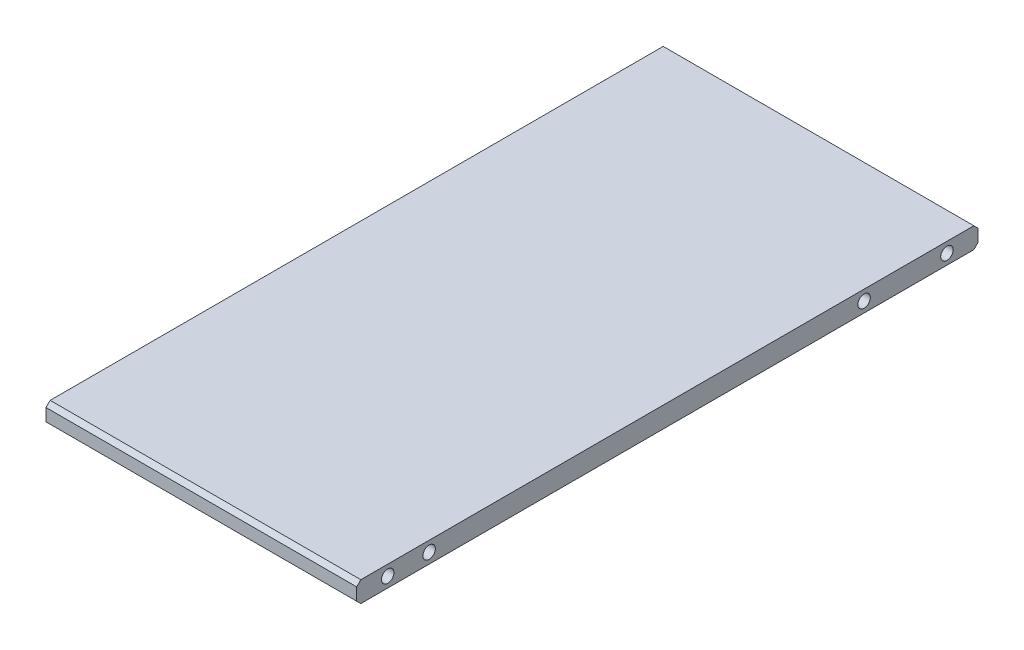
SolidWorks part; units mm, degrees
ref_plane "Alzado" through (0, 0, 0) normal (0, 0, 1) x (1, 0, 0)
ref_plane "Planta" through (0, 0, 0) normal (0, 1, 0) x (1, 0, 0)
ref_plane "Vista lateral" through (0, 0, 0) normal (1, 0, 0) x (0, 0, -1)
ref_plane "Plano1" through (0, -0.5, 0) normal (0, 1, 0) x (1, 0, 0)
sketch "Croquis1" plane through (0, -0.5, 0) normal (0, 1, 0) x (1, 0, 0)
  line L0 (0, 0) -> (0, 300)
  line L1 (0, 300) -> (-150, 300)
  line L2 (-150, 300) -> (-150, 0)
  line L3 (-150, 0) -> (0, 0)
  dimension "D1" = 150
  dimension "D2" = 300
  dimension "D3" = 0
  dimension "D4" = 0
extrude "Saliente-Extruir1" add sketch "Croquis1" against normal blind 10
chamfer "Chaflán1" distance 2 angle 45 4 edges at (-75, -10.5, 0) (-75, -10.5, -300) (-75, -0.5, -300) (-75, -0.5, 0)
sketch "Croquis8" plane through (0, 0, 0) normal (1, 0, 0) x (0, 0, -1)
  line L0 (300, -8.5) -> (300, -2.5) construction
  line L1 (0, -8.5) -> (0, -2.5) construction
  line L3 (2, -10.5) -> (298, -10.5) construction
  circle A0 centre (15, -5.5) radius 3
  circle A1 centre (245, -5.5) radius 3
  circle A2 centre (285, -5.5) radius 3
  circle A3 centre (35, -5.5) radius 3
  point P10 (0, -5.5)
  dimension "D1" = 6
  dimension "D2" = 6
  dimension "D5" = 6
  dimension "D10" = 6
  dimension "D3" = 40
  dimension "D4" = 15
  dimension "D6" = 15
  dimension "D7" = 5
  dimension "D8" = 5
  dimension "D9" = 5
  dimension "D11" = 20
  dimension "D12" = 5
extrude "Cortar-Extruir1" cut sketch "Croquis8" along direction (-1, 0, 0) on the side against the normal through all
